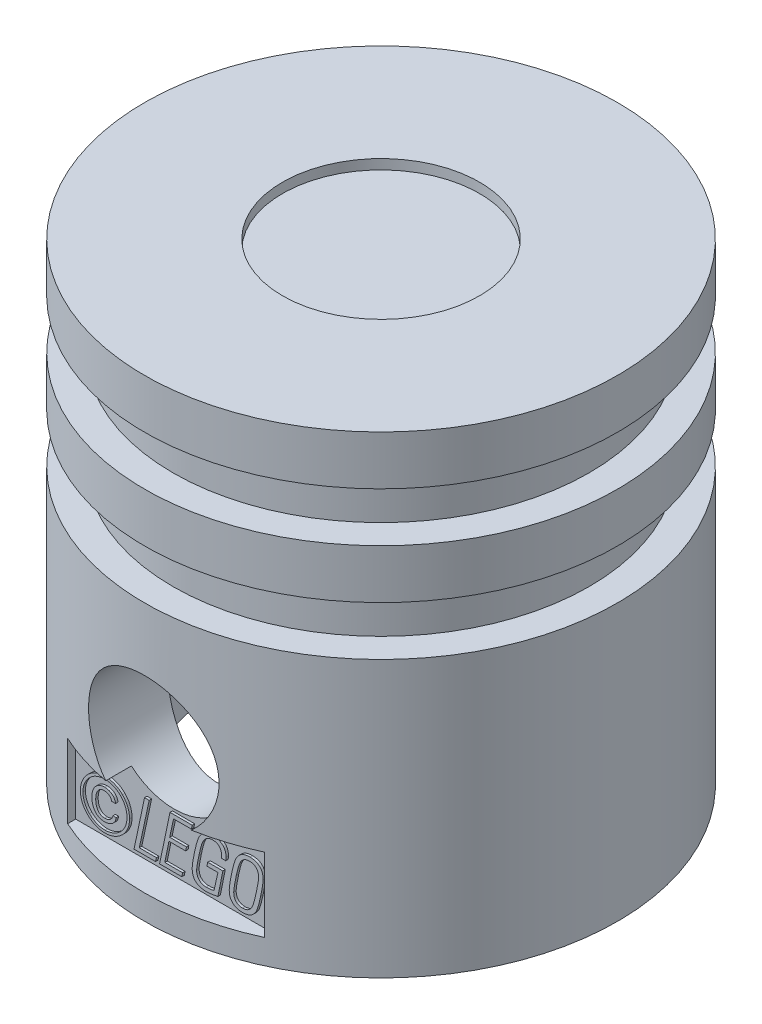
SolidWorks part; units mm, degrees
ref_plane "Plano1" through (0, 0, 0) normal (0, 0, 1) x (1, 0, 0)
ref_plane "Plano2" through (0, 0, 0) normal (0, 1, 0) x (1, 0, 0)
ref_plane "Plano3" through (0, 0, 0) normal (1, 0, 0) x (0, 0, -1)
sketch "Sketch1" plane through (0, 0, 0) normal (0, 0, 1) x (1, 0, 0)
  line L0 (0, 0) -> (0, 25.1494) construction
  line L1 (4.225, 8.6) -> (4.8, 8.6)
  line L2 (4.8, 0) -> (4.8, 5.6)
  line L3 (4.8, 9.6) -> (0, 9.6)
  line L4 (3.3, 0) -> (4.8, 0)
  line L5 (3.3, 3) -> (3.3, 0)
  line L6 (0, 6) -> (0, 9.6)
  line L7 (3, 3) -> (3.3, 3)
  line L8 (4.225, 7.6) -> (4.8, 7.6)
  line L9 (4.225, 6.6) -> (4.8, 6.6)
  line L10 (4.225, 5.6) -> (4.8, 5.6)
  line L11 (4.225, 5.6) -> (4.225, 6.6)
  line L12 (4.8, 8.6) -> (4.8, 9.6)
  line L13 (4.225, 7.6) -> (4.225, 8.6)
  line L14 (4.8, 6.6) -> (4.8, 7.6)
  arc A0 (3, 3) -> (0, 6) centre (0, 3) ccw
  dimension "D4" = 6
  dimension "D1" = 4.8
  dimension "D2" = 9.6
  dimension "D3" = 1.5
  dimension "D5" = 1
  dimension "D6" = 1
  dimension "D7" = 1
  dimension "D8" = 1
revolve "Base-Revolve" add sketch "Sketch1" angle 360 about L0
sketch "Sketch2" plane through (0, 0, 0) normal (0, 0, 1) x (1, 0, 0)
  line L0 (0, 0) -> (0, 6.3829) construction
  line L1 (0, 0) -> (0, 25.1494) construction
  circle A0 centre (0, 3) radius 1.325
  arc A1 (3, 3) -> (-3, 3) centre (0, 3) ccw construction
  dimension "D1" = 2.65
extrude "Cut-Extrude1" cut sketch "Sketch2" against normal through all and the other way through all
sketch "Sketch3" plane through (0, 9.6, 0) normal (0, 1, 0) x (-1, 0, 0)
  circle A0 centre (0, 0) radius 2
  dimension "D1" = 4
extrude "Cut-Extrude2" cut sketch "Sketch3" against normal blind 0.2
ref_plane "Plane1" through (0, 0, 4.2) normal (0, 0, 1) x (1, 0, 0)
sketch "Sketch4" plane through (0, 0, 4.2) normal (0, 0, 1) x (1, 0, 0)
  line L0 (-4.8, 0) -> (4.8, 0) construction
  line L1 (-2, 2) -> (2, 2)
  line L2 (-2, 2) -> (-2, 0.5)
  line L3 (-2, 0.5) -> (2, 0.5)
  line L4 (2, 2) -> (2, 0.5)
  dimension "D1" = 4
  dimension "D2" = 2
  dimension "D3" = 1.5
  dimension "D4" = 0.5
extrude "Cut-Extrude3" cut sketch "Sketch4" along normal blind 1
sketch "Sketch5" plane through (0, 0, 4.2) normal (0, 0, 1) x (1, 0, 0)
  text T0 "©LEGO" font "Zurich LtCn BT" height in points 4
extrude "Boss-Extrude1" add sketch "Sketch5" along normal blind 0.05
